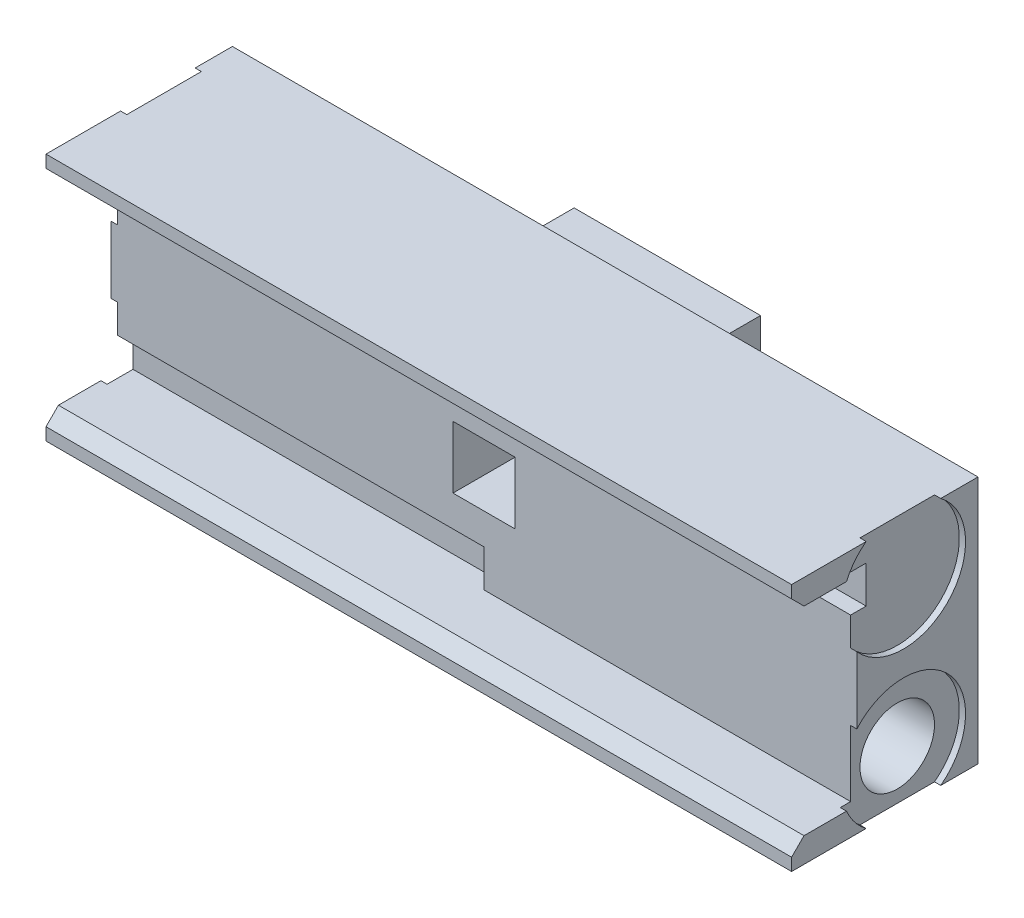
SolidWorks part; units mm, degrees
ref_plane "Front Plane" through (0, 0, 0) normal (0, 0, 1) x (1, 0, 0)
ref_plane "Top Plane" through (0, 0, 0) normal (0, 1, 0) x (1, 0, 0)
ref_plane "Right Plane" through (0, 0, 0) normal (1, 0, 0) x (0, 0, -1)
sketch "Sketch1" plane through (0, 0, 0) normal (0, 0, 1) x (1, 0, 0)
  line L1 (-60, -20) -> (60, -20)
  line L2 (-60, -20) -> (-60, 20)
  line L3 (-60, 20) -> (60, 20)
  line L4 (60, -20) -> (60, 20)
  line L5 (-60, -20) -> (60, 20) construction
  line L6 (-60, 20) -> (60, -20) construction
  point P0 (0, 0)
  dimension "D1" = 120
  dimension "D2" = 40
extrude "Boss-Extrude1" add sketch "Sketch1" along normal blind 30
sketch "Sketch2" plane through (60, 0, 0) normal (1, 0, 0) x (0, 0, -1)
  line L0 (-30, -20) -> (0, -20) construction
  line L1 (-30, 16) -> (-19.7821, 16)
  line L2 (-30, 16) -> (-30, -16)
  line L3 (-30, -16) -> (-19.5, -16)
  line L4 (-19.5, 10) -> (-19.5, -16)
  line L5 (-19.7821, 16) -> (-17, 16)
  line L7 (-19.5, 10) -> (-17, 10)
  line L8 (-17, 16) -> (-17, 10)
  line L9 (-30, 20) -> (0, 20) construction
  line L10 (-30, -20) -> (-30, 20) construction
  dimension "D1" = 4
  dimension "D2" = 2.5
  dimension "D3" = 6
  dimension "D4" = 13
  dimension "D5" = 4
extrude "Cut-Extrude1" cut sketch "Sketch2" against normal blind 60
sketch "Sketch3" plane through (-60, 0, 0) normal (-1, 0, 0) x (0, 0, 1)
  line L0 (30, 20) -> (30, -20) construction
  line L1 (30, 16) -> (19.5, 16)
  line L2 (30, 16) -> (30, -16)
  line L3 (30, -16) -> (18.437, -16)
  line L4 (19.5, 16) -> (19.5, -10)
  line L5 (30, 20) -> (0, 20) construction
  line L6 (18.437, -16) -> (17, -16)
  line L8 (19.5, -10) -> (17, -10)
  line L9 (17, -16) -> (17, -10)
  line L10 (30, -20) -> (0, -20) construction
  dimension "D1" = 4
  dimension "D2" = 4
  dimension "D3" = 13
  dimension "D4" = 2.5
  dimension "D5" = 6
extrude "Cut-Extrude2" cut sketch "Sketch3" against normal blind 60
sketch "Sketch4" plane through (0, 0, 0) normal (0, 0, -1) x (-1, 0, 0)
  line L1 (-15, -15) -> (15, -15)
  line L2 (-15, -15) -> (-15, 15)
  line L3 (-15, 15) -> (15, 15)
  line L4 (15, -15) -> (15, 15)
  line L5 (-15, -15) -> (15, 15) construction
  line L6 (-15, 15) -> (15, -15) construction
  point P0 (0, 0)
  dimension "D1" = 30
  dimension "D2" = 30
extrude "Boss-Extrude2" add sketch "Sketch4" along normal blind 10
sketch "Sketch5" plane through (60, 0, 0) normal (1, 0, 0) x (0, 0, -1)
  line L0 (0, 0) -> (-12, 0) construction
  line L1 (-12, -12) -> (-12, 12) construction
  circle A0 centre (-12, 12) radius 10
  circle A1 centre (-12, -12) radius 10
  point P5 (-12, 0)
  dimension "D3" = 20
  dimension "D4" = 20
  dimension "D1" = 12
  dimension "D2" = 24
extrude "Cut-Extrude3" cut sketch "Sketch5" against normal blind 1
sketch "Sketch7" plane through (59, 0, 0) normal (1, 0, 0) x (0, 0, -1)
  circle A0 centre (-12, -12) radius 6
  dimension "D1" = 12
extrude "Cut-Extrude5" cut sketch "Sketch7" against normal blind 55
mirror "Mirror1" about plane through (0, 0, 0) normal (1, 0, 0) of "Cut-Extrude3"
sketch "Sketch6" plane through (0, 0, 19.5) normal (0, 0, 1) x (1, 0, 0)
  line L5 (-5, -5) -> (5, -5)
  line L6 (-5, -5) -> (-5, 5)
  line L7 (-5, 5) -> (5, 5)
  line L8 (5, -5) -> (5, 5)
  line L9 (-5, -5) -> (5, 5) construction
  line L10 (-5, 5) -> (5, -5) construction
  point P2 (0, 0)
  dimension "D1" = 10
  dimension "D2" = 10
extrude "Cut-Extrude4" cut sketch "Sketch6" against normal blind 10
chamfer "Chamfer1" distance 2 angle 45 2 edges at (0, 16, 30) (0, -16, 30)
sketch "Sketch8" plane through (-59, 0, 0) normal (-1, 0, 0) x (0, 0, 1)
  circle A0 centre (12, 12) radius 6
  dimension "D1" = 12
extrude "Cut-Extrude6" cut sketch "Sketch8" against normal blind 55
